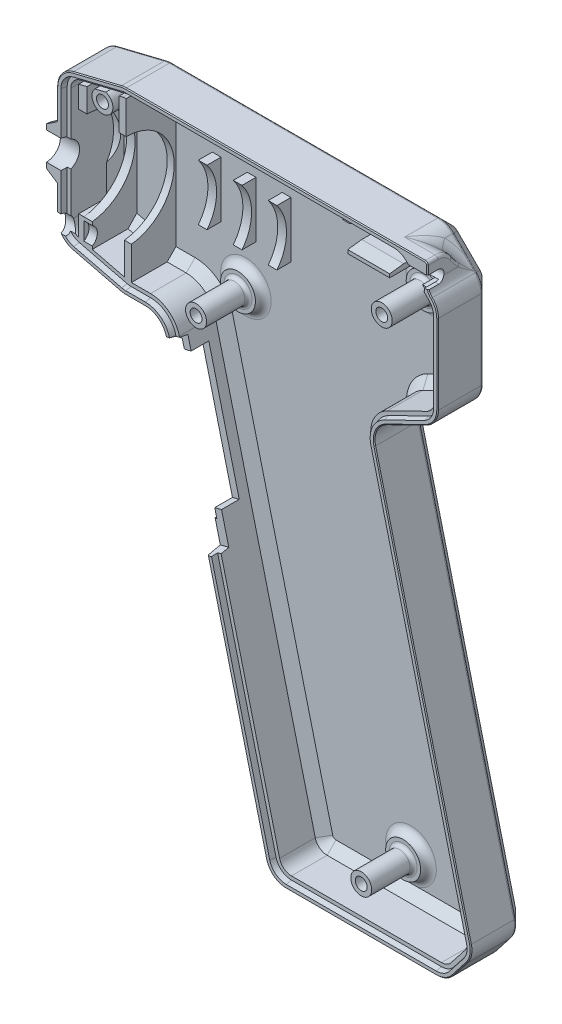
SolidWorks part; units mm, degrees
other "<corps gauche essai 4>-<décoration>"
ref_plane "Plan de face" through (0, 0, 0) normal (0, 0, 1) x (1, 0, 0)
ref_plane "Plan de dessus" through (0, 0, 0) normal (0, 1, 0) x (1, 0, 0)
ref_plane "Plan de droite" through (0, 0, 0) normal (1, 0, 0) x (0, 0, -1)
mirrored part "corps essai 4_Symétrique"
other "Empreinte1"
other "corps gauche essai 4<1>@assemblage essai 41"
sketch "Esquisse16" plane through (0, 0, 0) normal (0, 0, 1) x (1, 0, 0)
  line L4 (17.85, -19.175) -> (17.85, -22.807) construction
  line L5 (19.7256, -23.1634) -> (19.85, -23.1634) construction
  line L6 (19.7256, -22.9134) -> (19.85, -22.9134)
  line L7 (17.9096, -22.5642) -> (18.9509, -22.8198)
  line L8 (19.7256, -22.9134) -> (19.85, -22.9134)
  line L9 (17.85, -22.5496) -> (18.9509, -22.8198)
  line L10 (17.85, -22.807) -> (18.8913, -23.0626) construction
  line L11 (19.7256, -23.1634) -> (19.85, -23.1634)
  line L12 (17.85, -22.807) -> (18.8913, -23.0626)
  line L13 (17.85, -22.5496) -> (17.85, -22.807)
  line L14 (19.85, -22.9134) -> (19.85, -23.1634)
  line L15 (6.25, -19.9598) -> (8.25, -19.9598)
  line L16 (8.25, -20.125) -> (8.25, -14.225) construction
  line L17 (8.25, -19.9598) -> (8.25, -20.4507)
  line L18 (8.25, -20.4507) -> (6.25, -19.9598)
  arc A2 (18.8913, -23.0626) -> (19.7256, -23.1634) centre (19.7256, -19.6634) ccw construction
  arc A3 (18.9509, -22.8198) -> (19.7256, -22.9134) centre (19.7256, -19.6634) ccw
  arc A4 (18.9509, -22.8198) -> (19.7256, -22.9134) centre (19.7256, -19.6634) ccw
  arc A5 (18.8913, -23.0626) -> (19.7256, -23.1634) centre (19.7256, -19.6634) ccw
  dimension "D1" = 0.25
extrude "Enlèv. mat.-Extru.9" cut sketch "Esquisse16" against normal up to surface (1.5 mm away)
chamfer "Chanfrein1" distance 0.25 angle 45 27 edges at (108.5444, 15.4716, 0) (106.6922, 18.1124, 0) (62.5017, 25.6634, 0) (105.8436, 25.4291, 0) (0, -11.125, 0) (11.4326, 23.8061, 0) (109, 1.7894, 0) (99.9146, -17.8004, 0) (104.7038, -82.3859, 0) (115.3177, -145.0098, 0) (87.1273, -149.8613, 0) (31.3797, -31.1972, 0) (22.5189, -25.6634, 0) (11.4326, -23.8061, 0) (0, 11.8973, 0) (1.2787, 19.9972, 0) (2.5431, -21.1986, 0) (19.0052, -25.62, 0) (61.9597, -148.5894, 0) (111.2311, -149.2541, 0) (118.4472, -140.0179, 0) (108.0929, -12.7716, 0) (19.0052, 25.62, 0) (50.6667, -108.5531, 0) (91.3877, -23.4736, 0) (29.0063, -26.9354, 0) (106.0779, 23.6384, 0)
ref_plane "Plan1" through (0, 0, -9) normal (0, 0, 1) x (1, 0, 0)
sketch "Esquisse7" [suppressed] plane through (0, 0, -9) normal (0, 0, 1) x (1, 0, 0)
  line L0 (14.0028, 21.8627) -> (17.85, 22.807)
  line L1 (14.0028, 21.8627) -> (17.85, 22.807)
  line L2 (8.25, -20.4507) -> (8.25, -10.3953)
  line L3 (8.25, 10.3953) -> (8.25, 20.4507)
  line L4 (8.25, 17.6181) -> (8.25, 20.4507)
  line L5 (8.25, 20.4507) -> (10.8884, 21.0983) construction
  line L6 (17.85, -22.807) -> (17.85, -10.3953)
  line L7 (17.85, 10.3953) -> (17.85, 22.807)
  line L8 (17.85, 17.6181) -> (17.85, 22.807)
  line L9 (8.25, 20.4507) -> (10.8884, 21.0983)
  arc A0 (8.25, 17.6181) -> (17.85, 17.6181) centre (13.05, 19.0181) ccw construction
  arc A1 (8.25, 17.6181) -> (17.85, 17.6181) centre (13.05, 19.0181) ccw
  circle A2 centre (87.1273, -137.8258) radius 5 construction
  circle A3 centre (87.1273, -137.8258) radius 3 construction
  circle A5 centre (93, 6.1634) radius 3 construction
  circle A7 centre (39.85, -20.6279) radius 3 construction
  circle A8 centre (13.05, 19.0181) radius 3 construction
  circle A9 centre (87.1273, -137.8258) radius 5
  circle A10 centre (87.1273, -137.8258) radius 3
  circle A11 centre (93, 6.1634) radius 5
  circle A12 centre (93, 6.1634) radius 3
  circle A13 centre (39.85, -20.6279) radius 5
  circle A14 centre (39.85, -20.6279) radius 3
  arc A15 (10.8884, 21.0983) -> (14.0028, 21.8627) centre (13.05, 19.0181) ccw
extrude "Boss.-Extru.2" [suppressed] add sketch "Esquisse7" against normal up to body
hole_wizard "Chambrage pour vis à tête hexagonale M31" positions "Esquisse4" profile "Esquisse5" counterbore size "M3" standard "ISO"
sketch "Esquisse4" plane through (0, 0, -16.75) normal (0, 0, -1) x (-1, 0, 0)
  point P0 (-93, 6.1634)
  point P3 (-13.05, 19.0181)
  point P6 (-39.85, -20.6279)
  point P9 (-87.1273, -137.8258)
sketch "Esquisse5" plane through (93, 6.1634, -16.75) normal (1, 0, 0) x (0, 1, 0)
  line L0 (0, 0) -> (0, 16.75)
  line L1 (0, 16.75) -> (1.6, 16.75)
  line L3 (1.6, 16.75) -> (1.6, 3.4)
  line L4 (1.6, 3.4) -> (3.25, 3.4)
  line L5 (3.25, 3.4) -> (3.25, 0)
  line L7 (3.25, 0) -> (0, 0)
  line L11 (0, -6.35) -> (0, 107.95) construction
  dimension "Diamètre du perçage jusqu'au prochain" = 3.2
  dimension "Profondeur du perçage jusqu'au prochain" = 16.75
  dimension "Diamètre du chambrage" = 6.5
  dimension "Profondeur du chambrage" = 3.4
sketch "Esquisse8" [suppressed] plane through (0, 0, 0) normal (0, 0, 1) x (1, 0, 0)
  line L0 (-8.4581, 32.4723) -> (-8.4581, -28.6607) construction
  line L1 (56.3429, -28.6607) -> (-8.4581, -28.6607) construction
  line L2 (56.3429, 32.4723) -> (-8.4581, 32.4723) construction
  line L3 (56.3429, 32.4723) -> (56.3429, -28.6607) construction
  line L4 (-8.4581, 32.4723) -> (-8.4581, -28.6607)
  line L5 (56.3429, -28.6607) -> (-8.4581, -28.6607)
  line L6 (56.3429, 32.4723) -> (-8.4581, 32.4723)
  line L7 (56.3429, 32.4723) -> (56.3429, -28.6607)
extrude "Enlèv. mat.-Extru.4" [suppressed] cut sketch "Esquisse8" against normal through all both and the other way through all flip side to cut
sketch "Esquisse9" [suppressed] plane through (0, 0, -16.75) normal (0, 0, -1) x (-1, 0, 0)
  line L4 (-23.85, 11.2) -> (-47.55, 11.2)
  line L5 (-23.85, -11.2) -> (-23.85, 11.2)
  line L6 (-47.55, -11.2) -> (-23.85, -11.2)
  line L7 (-47.55, 11.2) -> (-47.55, -11.2)
  line L8 (-23.85, 11.2) -> (-47.55, 11.2)
  line L9 (-23.85, -11.2) -> (-23.85, 11.2)
  line L10 (-47.55, -11.2) -> (-23.85, -11.2)
  line L11 (-47.55, 11.2) -> (-47.55, -11.2)
  dimension "D1" = 0
extrude "Enlèv. mat.-Extru.5" [suppressed] cut sketch "Esquisse9" against normal through all
sketch "Esquisse10" plane through (0, 0, -16.75) normal (0, 0, -1) x (-1, 0, 0)
  line L0 (0, 0) -> (-51.25, 0) construction
  line L1 (-51.25, 11.75) -> (-51.25, -11.75) construction
  line L2 (-51.25, 8) -> (-51.25, -8)
  line L3 (-41.25, 8) -> (-41.25, -8)
  line L4 (-31.25, 8) -> (-31.25, -8)
  point P9 (-51.25, 0)
  dimension "D1" = 16
  dimension "D3" = 10
  dimension "D2" = 3
extrude "Extru.-Mince1" add sketch "Esquisse10" against normal blind 8.5 thin
other "SupprimerFace3"
other "Empreinte2"
other "moteur<1>@assemblage essai 41"
other "Déplacer la face1" parameters "D1"=0.3
sketch "Esquisse11" plane through (0, 0, -13.35) normal (0, 0, -1) x (-1, 0, 0)
  line B0 (-95.7, 7.9724) -> (-95.7, 4.3544)
  line B1 (-93, 9.4134) -> (-93, 6.1634) construction
  line B2 (-94.7, 8.9334) -> (-94.7, 3.3935)
  line B3 (-91.3, 8.9334) -> (-91.3, 3.3935)
  line B4 (-90.3, 7.9724) -> (-90.3, 4.3544)
  arc B5 (-94.7, 8.9334) -> (-95.7, 7.9724) centre (-93, 6.1634) ccw
  arc B6 (-95.7, 4.3544) -> (-94.7, 3.3935) centre (-93, 6.1634) ccw
  arc B7 (-90.3, 4.3544) -> (-91.3, 3.3935) centre (-93, 6.1634) cw
  arc B8 (-91.3, 8.9334) -> (-90.3, 7.9724) centre (-93, 6.1634) cw
  line B9 (-15.75, 20.8271) -> (-15.75, 17.209)
  line B10 (-14.75, 21.788) -> (-14.75, 16.2481)
  line B11 (-11.35, 21.788) -> (-11.35, 16.2481)
  line B12 (-10.35, 20.8271) -> (-10.35, 17.209)
  arc B13 (-14.75, 21.788) -> (-15.75, 20.8271) centre (-13.05, 19.0181) ccw
  arc B14 (-15.75, 17.209) -> (-14.75, 16.2481) centre (-13.05, 19.0181) ccw
  arc B15 (-10.35, 17.209) -> (-11.35, 16.2481) centre (-13.05, 19.0181) cw
  arc B16 (-11.35, 21.788) -> (-10.35, 20.8271) centre (-13.05, 19.0181) cw
  line B17 (-42.55, -18.8189) -> (-42.55, -22.4369)
  line B18 (-41.55, -17.858) -> (-41.55, -23.3978)
  line B19 (-38.15, -17.858) -> (-38.15, -23.3978)
  line B20 (-37.15, -18.8189) -> (-37.15, -22.4369)
  arc B21 (-41.55, -17.858) -> (-42.55, -18.8189) centre (-39.85, -20.6279) ccw
  arc B22 (-42.55, -22.4369) -> (-41.55, -23.3978) centre (-39.85, -20.6279) ccw
  arc B23 (-37.15, -22.4369) -> (-38.15, -23.3978) centre (-39.85, -20.6279) cw
  arc B24 (-38.15, -17.858) -> (-37.15, -18.8189) centre (-39.85, -20.6279) cw
  line B25 (-89.8273, -136.0168) -> (-89.8273, -139.6348)
  line B26 (-88.8273, -135.0558) -> (-88.8273, -140.5957)
  line B27 (-85.4273, -135.0558) -> (-85.4273, -140.5957)
  line B28 (-84.4273, -136.0168) -> (-84.4273, -139.6348)
  arc B29 (-88.8273, -135.0558) -> (-89.8273, -136.0168) centre (-87.1273, -137.8258) ccw
  arc B30 (-89.8273, -139.6348) -> (-88.8273, -140.5957) centre (-87.1273, -137.8258) ccw
  arc B31 (-84.4273, -139.6348) -> (-85.4273, -140.5957) centre (-87.1273, -137.8258) cw
  arc B32 (-85.4273, -135.0558) -> (-84.4273, -136.0168) centre (-87.1273, -137.8258) cw
sketch_block_instance "Bloc1-1"
sketch_block "Bloc1" parameters "D1"=1
sketch_block_instance "Bloc1-2"
sketch_block_instance "Bloc1-3"
sketch_block_instance "Bloc1-4"
extrude "barrettes" add sketch "Esquisse11" along normal blind 0.25
sketch "Esquisse19" plane through (0, 0, -1.5) normal (0, 0, 1) x (1, 0, 0)
  line L1 (19.85, -22.9134) -> (17.352, -22.9134)
  line L2 (19.85, -22.9134) -> (19.85, -12.4608)
  line L3 (19.85, -12.4608) -> (17.352, -12.4608)
  line L4 (17.352, -22.9134) -> (17.352, -12.4608)
  line L5 (18.601, -12.4608) -> (18.601, -22.9134) construction
  line L6 (19.85, -17.6871) -> (17.352, -17.6871) construction
  point P116 (18.601, -17.6871)
  dimension "D1" = 10.4526
  dimension "D2" = 2.498
extrude "Enlèv. mat.-Extru.12" cut sketch "Esquisse19" along normal through all
other "Empreinte5"
other "corps gauche essai 4<1>@assemblage essai 44"
sketch "Esquisse20" plane through (22.2201, 5.5401, 0) normal (-0.9703, -0.2419, 0) x (0, 0, 1)
  line L0 (-2.8, -77.0392) -> (0, -77.0392) construction
  line L1 (-3.8, -85.8691) -> (-3.8, -79.701) construction
  line L2 (-3.8, -85.8691) -> (-0.25, -86.4951) construction
  line L3 (-3.8, -77.0392) -> (0, -77.0392)
  line L4 (-3.8, -85.8691) -> (-3.8, -77.0392)
  line L5 (-3.8, -85.8691) -> (0, -86.5392)
  line L7 (0, -79.7451) -> (0, -155.4711) construction
  line L8 (0, -77.0392) -> (0, -86.5392)
  line L9 (0, -38.7892) -> (0, -41.5392) construction
  line L10 (-3.8, -37.5165) -> (-0.25, -36.8906) construction
  line L11 (-3.8, -41.5392) -> (-3.8, -38.7892) construction
  line L12 (0, -36.8465) -> (0, -41.5392)
  line L13 (-3.8, -37.5165) -> (0, -36.8465)
  line L14 (-3.8, -41.5392) -> (-3.8, -37.5165)
  line L15 (-3.8, -41.5392) -> (0, -41.5392)
extrude "Enlèv. mat.-Extru.13" cut sketch "Esquisse20" against normal up to vertex
sketch "Esquisse13" plane through (17.19, -38.6095, 0) normal (0.4067, -0.9135, 0) x (0.9135, 0.4067, 0)
  line L3 (15.8014, -10.4118) -> (16.3091, -10.5)
  line L4 (16.3091, -3.8) -> (15.8014, -3.8)
  line L5 (15.8014, -3.8) -> (15.8014, -10.4118)
  line L8 (15.8014, -3.8) -> (15.8014, -10.4118)
  line L10 (15.8014, -10.4118) -> (16.3091, -10.5)
  line L11 (16.3091, -10.5) -> (16.3091, -3.8)
  line L12 (16.3091, -10.5) -> (16.3091, -3.8)
  line L19 (16.3091, -3.8) -> (15.8014, -3.8)
  dimension "D1" = 0
sketch "Esquisse14" plane through (5.1978, -74.3321, 0) normal (-0.0698, 0.9976, 0) x (0.9976, 0.0698, 0)
  line L3 (36.9001, 3.8) -> (36.9001, 10.5)
  line L4 (36.3924, 10.4118) -> (36.3924, 3.8)
  line L5 (36.3924, 3.8) -> (36.9001, 3.8)
  line L7 (36.3924, 10.4118) -> (36.3924, 3.8)
  line L10 (36.9001, 3.8) -> (36.9001, 10.5)
  line L11 (36.9001, 10.5) -> (36.3924, 10.4118)
  line L12 (36.9001, 10.5) -> (36.3924, 10.4118)
  line L19 (36.3924, 3.8) -> (36.9001, 3.8)
  dimension "D1" = 0
sketch "Esquisse15" plane through (0, 0, -1.5) normal (0, 0, 1) x (1, 0, 0)
  line L0 (17.85, 13.6679) -> (19.85, 13.6679)
  line L1 (19.85, 13.6679) -> (17.85, 13.6679)
  line L2 (19.85, 13.6679) -> (17.85, 13.6679)
  line L3 (6.25, -13.6679) -> (6.25, -19.9598)
  line L4 (6.25, 13.6679) -> (8.25, 13.6679)
  line L5 (8.25, -13.6679) -> (6.25, -13.6679)
  line L6 (8.25, -13.6679) -> (6.25, -13.6679)
  line L17 (25.3123, -23.1634) -> (19.85, -23.1634)
  line L18 (19.85, -23.1634) -> (19.85, -13.6679)
  line L20 (19.85, -23.1634) -> (19.85, 13.6679)
  line L22 (17.85, -13.6679) -> (17.85, -22.807)
  line L24 (17.85, 13.6679) -> (17.85, -22.807)
  line L26 (17.85, -22.807) -> (8.25, -20.4507)
  line L28 (6.25, -19.9598) -> (5.1657, -19.6937)
  line L29 (3.8813, -19.0804) -> (2.5541, -19.0804)
  line L30 (4.9437, -20.598) -> (18.6693, -23.9669)
  line L31 (19.7256, -24.0946) -> (25.3123, -24.0946)
  line L32 (17.85, -22.807) -> (8.25, -20.4507)
  line L33 (33.6238, -29.8637) -> (33.5598, -29.6071)
  line L34 (25.3123, -23.1634) -> (19.85, -23.1634)
  line L45 (6.25, -19.9598) -> (5.1657, -19.6937)
  line L46 (3.8813, -19.0804) -> (2.5541, -19.0804)
  line L47 (4.9437, -20.598) -> (18.6693, -23.9669)
  line L48 (19.7256, -24.0946) -> (25.3123, -24.0946)
  line L50 (33.6238, -29.8637) -> (33.5598, -29.6071)
  line L54 (8.25, -20.4507) -> (8.25, -19.9598)
  line L55 (8.25, -20.4507) -> (8.25, -13.6679)
  line L56 (8.25, -19.9598) -> (6.25, -19.9598)
  line L58 (32.6563, -29.8324) -> (32.7203, -30.089)
  line L64 (32.6563, -29.8324) -> (32.7203, -30.089)
  line L67 (32.7203, -30.089) -> (33.6238, -29.8637)
  line L69 (19.85, -13.6679) -> (17.85, -13.6679)
  line L71 (32.7203, -30.089) -> (33.6238, -29.8637)
  arc A5 (3.8813, -19.0804) -> (5.1657, -19.6937) centre (6, -16.2946) ccw
  arc A6 (2.5541, -19.0804) -> (4.9437, -20.598) centre (6, -16.2946) ccw
  arc A7 (18.6693, -23.9669) -> (19.7256, -24.0946) centre (19.7256, -19.6634) ccw
  arc A8 (32.6563, -29.8324) -> (25.3123, -24.0946) centre (25.3123, -31.6634) ccw
  arc A9 (33.5598, -29.6071) -> (25.3123, -23.1634) centre (25.3123, -31.6634) ccw
  arc A10 (3.8813, -19.0804) -> (5.1657, -19.6937) centre (6, -16.2946) ccw
  arc A11 (2.5541, -19.0804) -> (4.9437, -20.598) centre (6, -16.2946) ccw
  arc A12 (18.6693, -23.9669) -> (19.7256, -24.0946) centre (19.7256, -19.6634) ccw
  arc A13 (32.6563, -29.8324) -> (25.3123, -24.0946) centre (25.3123, -31.6634) ccw
  arc A14 (33.5598, -29.6071) -> (25.3123, -23.1634) centre (25.3123, -31.6634) ccw
  dimension "D1" = 0
extrude "Enlèv. mat.-Extru.8" cut sketch "Esquisse15" along normal through all
other "Déplacer la face2" parameters "D1"=0.4
sketch "Esquisse18" [suppressed] plane through (0, 0, -2.8) normal (0, 0, 1) x (1, 0, 0)
  line L0 (41.3427, -69.0897) -> (43.6462, -70.0613) construction
  line L1 (43.6462, -70.0613) -> (43.2833, -68.6059) construction
  line L2 (43.2833, -68.6059) -> (41.3427, -69.0897) construction
  line L3 (34.6951, -34.1604) -> (34.3322, -32.705) construction
  line L4 (34.3322, -32.705) -> (32.7545, -34.6442) construction
  line L5 (32.7545, -34.6442) -> (34.6951, -34.1604) construction
  line L6 (41.3427, -69.0897) -> (43.6462, -70.0613)
  line L7 (43.6462, -70.0613) -> (43.2833, -68.6059)
  line L8 (43.2833, -68.6059) -> (41.3427, -69.0897)
  line L9 (34.6951, -34.1604) -> (34.3322, -32.705)
  line L10 (34.3322, -32.705) -> (32.7545, -34.6442)
  line L11 (32.7545, -34.6442) -> (34.6951, -34.1604)
extrude "Enlèv. mat.-Extru.11" [suppressed] cut sketch "Esquisse18" against normal up to surface (1 mm away)
other "Déplacer la face3" parameters "D1"=0.25
sketch "Esquisse21" plane through (0, 0, -1.5) normal (0, 0, 1) x (1, 0, 0)
  line L6 (6.25, -13.6679) -> (6.25, -14.6348) construction
  line L7 (5.1657, -19.6937) -> (6.25, -19.9598) construction
  line L8 (6.25, -13.6679) -> (6.25, -19.9598)
  line L9 (5.1657, -19.6937) -> (6.25, -19.9598)
  line L10 (6.25, -13.6679) -> (4.75, -13.6679)
  line L11 (4.75, -13.6679) -> (4.75, -19.5638)
  arc A0 (3.8813, -19.0804) -> (5.1657, -19.6937) centre (6, -16.2946) ccw construction
  arc A1 (4.75, -19.5638) -> (5.1657, -19.6937) centre (6, -16.2946) ccw
  dimension "D1" = 1.5
extrude "Boss.-Extru.3" add sketch "Esquisse21" against normal up to body
other "SupprimerFace1"
other "SupprimerFace2"
other "Déplacer la face5" parameters "D1"=0.1
other "Déplacer la face6" parameters "D1"=0.1
other "Déplacer la face4" parameters "D1"=0.1
sketch "Esquisse23" plane through (30.25, 0, 0) normal (-1, 0, 0) x (0, 0, 1)
  circle A0 centre (0, 0) radius 13
  dimension "D1" = 26
extrude "Enlèv. mat.-Extru.14" cut sketch "Esquisse23" against normal up to surface (22.5 mm away)
sketch "Esquisse24" plane through (0, 0, -7.7) normal (0, 0, 1) x (1, 0, 0)
  line L6 (101.0787, 16.4634) -> (75.7779, 16.4634) construction
  line L7 (77.2779, 20.6634) -> (74.2779, 20.6634)
  line L8 (77.2779, 20.6634) -> (77.2779, 16.4634)
  line L9 (77.2779, 16.4634) -> (74.2779, 16.4634)
  line L10 (74.2779, 20.6634) -> (74.2779, 16.4634)
  line L11 (75.7779, 16.4634) -> (75.7779, 20.6634) construction
  dimension "D1" = 1.5
extrude "Boss.-Extru.4" add sketch "Esquisse24" against normal up to surface (6.55 mm away)
sketch "Esquisse25" plane through (0, 0, -7.7) normal (0, 0, 1) x (1, 0, 0)
  line L0 (77.2779, 16.4634) -> (74.2779, 16.4634) construction
  line L1 (77.2779, 20.6634) -> (76.6779, 20.6634)
  line L2 (77.2779, 20.6634) -> (77.2779, 16.4634)
  line L3 (77.2779, 16.4634) -> (76.6779, 16.4634)
  line L4 (76.6779, 20.6634) -> (76.6779, 16.4634)
  dimension "D1" = 0.6
extrude "Enlèv. mat.-Extru.15" cut sketch "Esquisse25" against normal up to surface (1 mm away)
chamfer "Chanfrein2" distance 0.5 distance2 1 3 edges at (76.6779, 16.4634, -8.2) (76.6779, 20.6634, -8.2) (76.6779, 18.5634, -7.7)
